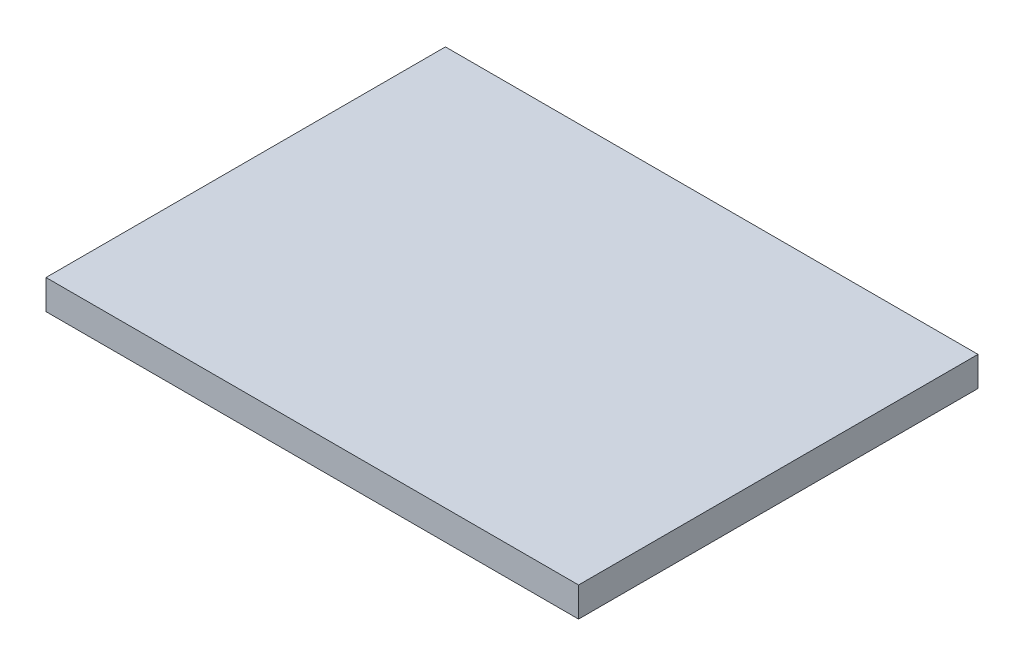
SolidWorks part; units mm, degrees
ref_plane "Face" through (0, 0, 0) normal (0, 0, 1) x (1, 0, 0)
ref_plane "Dessus" through (0, 0, 0) normal (0, 1, 0) x (1, 0, 0)
ref_plane "Droite" through (0, 0, 0) normal (1, 0, 0) x (0, 0, -1)
sketch "Esquisse1" plane through (0, 0, 0) normal (0, -1, 0) x (0, 0, 1)
  line L1 (0, 0) -> (27, 0)
  line L2 (0, 0) -> (0, 36)
  line L3 (0, 36) -> (27, 36)
  line L4 (27, 0) -> (27, 36)
  dimension "D1" = 36
  dimension "D2" = 27
extrude "Extrusion1" add sketch "Esquisse1" along normal blind 2
sketch "Esquisse2" plane through (0, -2, 0) normal (0, -1, 0) x (0, 0, -1)
  line L2 (-23.9495, -6) -> (-19.0505, -6)
  line L3 (-27, 0) -> (-27, -36) construction
  line L4 (0, 0) -> (-27, 0) construction
  line L5 (-7.9495, -6) -> (-3.0505, -6)
  line L6 (0, -36) -> (0, 0) construction
  arc A0 (-7.9495, -6) -> (-3.0505, -6) centre (-5.5, -5.5) cw
  arc A1 (-23.9495, -6) -> (-19.0505, -6) centre (-21.5, -5.5) cw
  dimension "D1" = 5.5
  dimension "D3" = 2.5
  dimension "D2" = 5.5
  dimension "D4" = 5.5
extrude "Extrusion2" add sketch "Esquisse2" along normal blind 3
